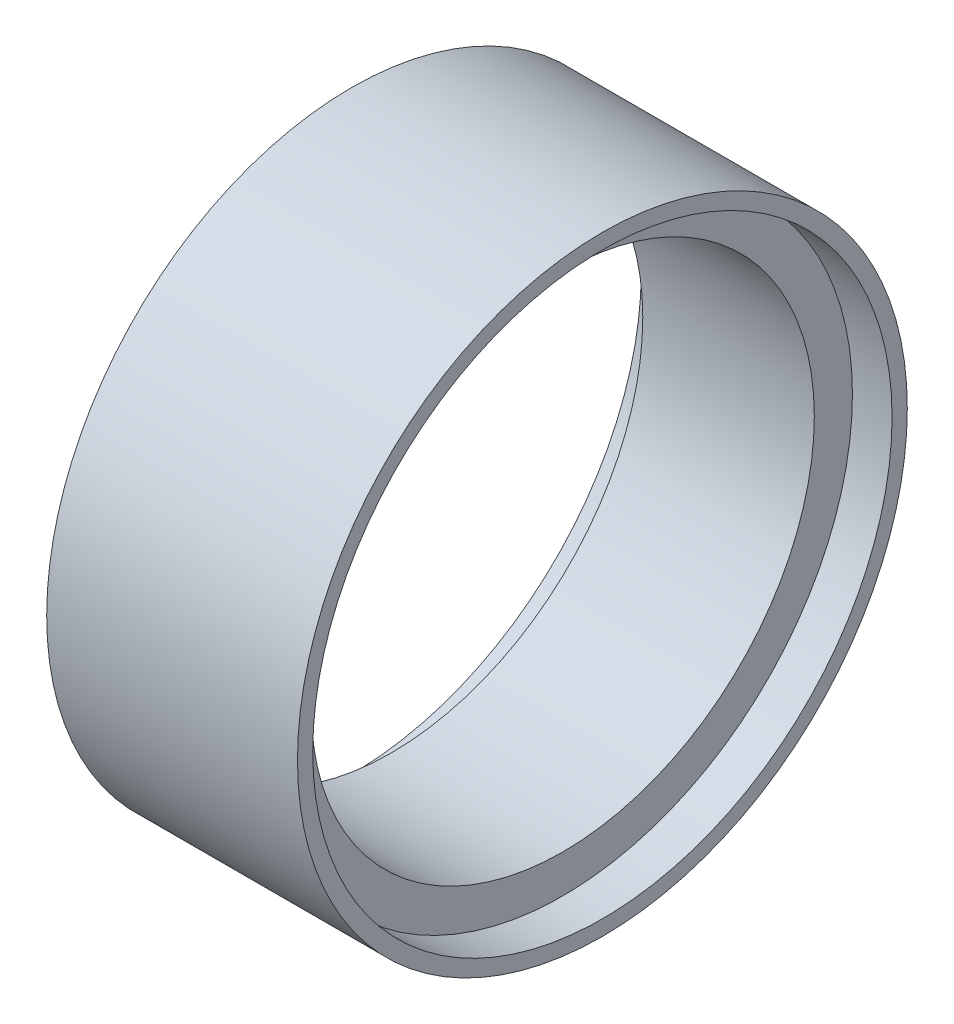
SolidWorks part; units mm, degrees
ref_plane "Plan de face" through (0, 0, 0) normal (0, 0, 1) x (1, 0, 0)
ref_plane "Plan de dessus" through (0, 0, 0) normal (0, 1, 0) x (1, 0, 0)
ref_plane "Plan de droite" through (0, 0, 0) normal (1, 0, 0) x (0, 0, -1)
sketch "Esquisse1" plane through (0, 0, 0) normal (0, 0, 1) x (1, 0, 0)
  line L0 (0, 0) -> (53.4682, 0) construction
  line L1 (0, 38) -> (0, 40)
  line L2 (0, 40) -> (32.9, 40)
  line L3 (32.9, 40) -> (32.9, 38)
  line L4 (32.9, 38) -> (27.7, 38)
  line L5 (27.7, 38) -> (27.7, 33)
  line L6 (27.7, 33) -> (5.2, 33)
  line L7 (5.2, 33) -> (5.2, 38)
  line L8 (5.2, 38) -> (0, 38)
  dimension "D1" = 66
  dimension "D2" = 80
  dimension "D3" = 32.9
  dimension "D4" = 22.5
  dimension "D5" = 5.2
  dimension "D6" = 76
  dimension "D7" = 76
revolve "Révolution1" add sketch "Esquisse1" angle 360 about L0
